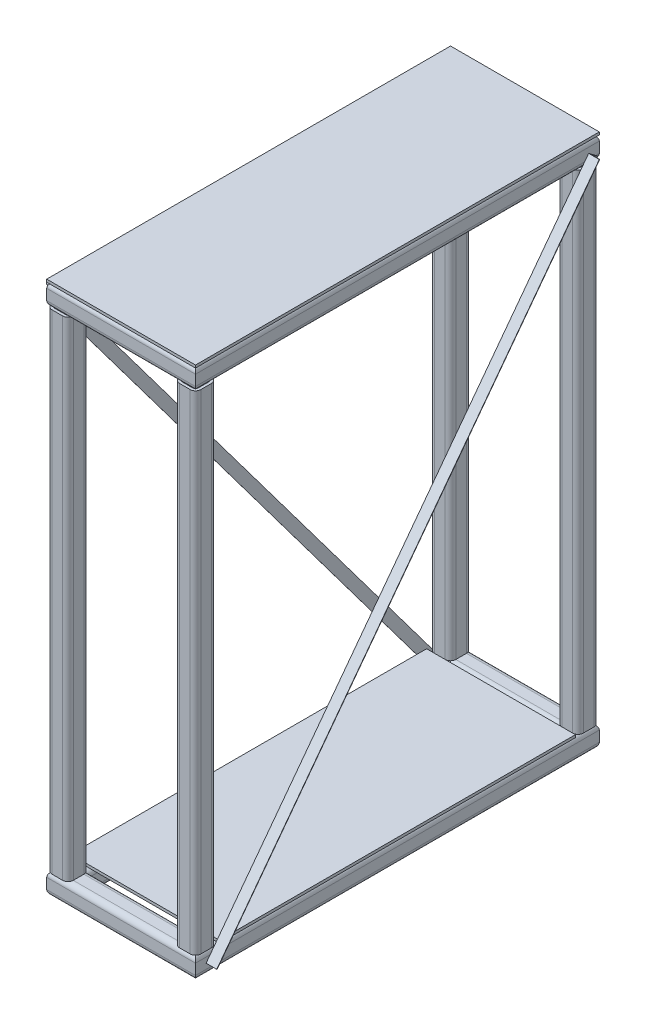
SolidWorks part; units mm, degrees
other "DetailItem37" parameters "D1"=109.4792, "D2"=100.0708
other "DetailItem38"
other "DetailItem39"
other "DetailItem40"
other "DetailItem41"
other "Grid System1" parameters "D1"=1219.2, "D2"=1219.2, "D3"=0, "D4"=0
sketch "Sketch1" plane through (0, 0, 0) normal (0, 1, 0) x (1, 0, 0)
  line L0 (-152.4, 0) -> (152.4, 0)
  line L1 (-152.4, 457.2) -> (152.4, 457.2)
  line L2 (-152.4, 457.2) -> (-152.4, -457.2)
  line L3 (-152.4, -457.2) -> (152.4, -457.2)
  line L4 (152.4, 457.2) -> (152.4, -457.2)
  line L5 (-152.4, 457.2) -> (152.4, -457.2) construction
  line L6 (-152.4, -457.2) -> (152.4, 457.2) construction
  point P8 (-152.4, 0)
  point P9 (152.4, 0)
  point P10 (-152.4, 457.2)
  point P11 (152.4, 457.2)
  point P12 (-152.4, -457.2)
  point P13 (152.4, -457.2)
ref_plane "Level1" through (0, 1219.2, 0) normal (0, 1, 0) x (1, 0, 0)
sketch "Sketch2" plane through (0, 1219.2, 0) normal (0, 1, 0) x (1, 0, 0)
  line L0 (-152.4, 0) -> (152.4, 0)
  line L1 (-152.4, 457.2) -> (152.4, 457.2)
  line L2 (-152.4, 457.2) -> (-152.4, -457.2)
  line L3 (-152.4, -457.2) -> (152.4, -457.2)
  line L4 (152.4, 457.2) -> (152.4, -457.2)
  line L5 (-152.4, 457.2) -> (152.4, -457.2) construction
  line L6 (-152.4, -457.2) -> (152.4, 457.2) construction
  point P8 (-152.4, 0)
  point P9 (152.4, 0)
  point P10 (-152.4, 457.2)
  point P11 (152.4, 457.2)
  point P12 (-152.4, -457.2)
  point P13 (152.4, -457.2)
sketch3d "3DSketch1"
  line L0 (-152.4, 0, 0) -> (-152.4, 1219.2, 0)
  line L1 (152.4, 0, 0) -> (152.4, 1219.2, 0)
  line L2 (-152.4, 0, -457.2) -> (-152.4, 1219.2, -457.2)
  line L3 (152.4, 0, -457.2) -> (152.4, 1219.2, -457.2)
  line L4 (-152.4, 0, 457.2) -> (-152.4, 1219.2, 457.2)
  line L5 (152.4, 0, 457.2) -> (152.4, 1219.2, 457.2)
surface "Surface-Extrude1" sketch "Sketch1"
ref_plane "Front Plane" through (0, 0, 0) normal (0, 0, 1) x (1, 0, 0)
ref_plane "Top Plane" through (0, 0, 0) normal (0, 1, 0) x (1, 0, 0)
ref_plane "Right Plane" through (0, 0, 0) normal (1, 0, 0) x (0, 0, -1)
other "Structural Member1"
ref_plane "Plane2" through (152.4, 0, -457.2) normal (0, 0, 1) x (1, 0, 0)
sketch "Sketch11" plane through (152.4, 0, -457.2) normal (0, 0, 1) x (1, 0, 0)
  line L0 (-12.7, -19.05) -> (12.7, -19.05)
  line L1 (-19.05, -12.7) -> (-19.05, 12.7)
  line L2 (12.7, 19.05) -> (-12.7, 19.05)
  line L3 (19.05, 12.7) -> (19.05, -12.7)
  line L4 (-12.7, -25.4) -> (12.7, -25.4)
  line L5 (-25.4, -12.7) -> (-25.4, 12.7)
  line L6 (12.7, 25.4) -> (-12.7, 25.4)
  line L7 (25.4, 12.7) -> (25.4, -12.7)
  line L8 (0, 0) -> (19.05, 0) construction
  line L9 (0, 0) -> (0, 19.05) construction
  arc A0 (25.4, 12.7) -> (12.7, 25.4) centre (12.7, 12.7) ccw
  arc A1 (12.7, -25.4) -> (25.4, -12.7) centre (12.7, -12.7) ccw
  arc A2 (-25.4, -12.7) -> (-12.7, -25.4) centre (-12.7, -12.7) ccw
  arc A3 (-12.7, 25.4) -> (-25.4, 12.7) centre (-12.7, 12.7) ccw
  arc A4 (-12.7, 19.05) -> (-19.05, 12.7) centre (-12.7, 12.7) ccw
  arc A5 (19.05, 12.7) -> (12.7, 19.05) centre (12.7, 12.7) ccw
  arc A6 (12.7, -19.05) -> (19.05, -12.7) centre (12.7, -12.7) ccw
  arc A7 (-19.05, -12.7) -> (-12.7, -19.05) centre (-12.7, -12.7) ccw
  point P3 (0, 25.4)
  point P4 (25.4, 0)
  point P5 (0, -25.4)
  point P6 (-25.4, 0)
  point P7 (-25.4, 25.4)
  point P8 (-25.4, -25.4)
  point P33 (0, 0)
  point P35 (25.4, -25.4)
  point P36 (25.4, 25.4)
  point P37 (0, 0)
  dimension "D1" = 12.7
  dimension "Thickness" = 6.35
  dimension "V_leg" = 50.8
other "Structural Member2"
ref_plane "Plane3" through (-152.4, 1219.2, 457.2) normal (1, 0, 0) x (0, 0, -1)
sketch "Sketch12" plane through (-152.4, 1219.2, 457.2) normal (1, 0, 0) x (0, 0, -1)
  line L0 (-12.7, -19.05) -> (12.7, -19.05)
  line L1 (-19.05, -12.7) -> (-19.05, 12.7)
  line L2 (12.7, 19.05) -> (-12.7, 19.05)
  line L3 (19.05, 12.7) -> (19.05, -12.7)
  line L4 (-12.7, -25.4) -> (12.7, -25.4)
  line L5 (-25.4, -12.7) -> (-25.4, 12.7)
  line L6 (12.7, 25.4) -> (-12.7, 25.4)
  line L7 (25.4, 12.7) -> (25.4, -12.7)
  line L8 (0, 0) -> (19.05, 0) construction
  line L9 (0, 0) -> (0, 19.05) construction
  arc A0 (25.4, 12.7) -> (12.7, 25.4) centre (12.7, 12.7) ccw
  arc A1 (12.7, -25.4) -> (25.4, -12.7) centre (12.7, -12.7) ccw
  arc A2 (-25.4, -12.7) -> (-12.7, -25.4) centre (-12.7, -12.7) ccw
  arc A3 (-12.7, 25.4) -> (-25.4, 12.7) centre (-12.7, 12.7) ccw
  arc A4 (-12.7, 19.05) -> (-19.05, 12.7) centre (-12.7, 12.7) ccw
  arc A5 (19.05, 12.7) -> (12.7, 19.05) centre (12.7, 12.7) ccw
  arc A6 (12.7, -19.05) -> (19.05, -12.7) centre (12.7, -12.7) ccw
  arc A7 (-19.05, -12.7) -> (-12.7, -19.05) centre (-12.7, -12.7) ccw
  point P3 (0, 25.4)
  point P4 (25.4, 0)
  point P5 (0, -25.4)
  point P6 (-25.4, 0)
  point P7 (-25.4, 25.4)
  point P8 (-25.4, -25.4)
  point P33 (0, 0)
  point P35 (25.4, -25.4)
  point P36 (25.4, 25.4)
  point P37 (0, 0)
  dimension "D1" = 12.7
  dimension "Thickness" = 6.35
  dimension "V_leg" = 50.8
other "Structural Member3"
ref_plane "Plane4" through (152.4, 0, 457.2) normal (0, 1, 0) x (1, 0, 0)
sketch "Sketch13" plane through (152.4, 0, 457.2) normal (0, 1, 0) x (1, 0, 0)
  line L0 (-12.7, -19.05) -> (12.7, -19.05)
  line L1 (-19.05, -12.7) -> (-19.05, 12.7)
  line L2 (12.7, 19.05) -> (-12.7, 19.05)
  line L3 (19.05, 12.7) -> (19.05, -12.7)
  line L4 (-12.7, -25.4) -> (12.7, -25.4)
  line L5 (-25.4, -12.7) -> (-25.4, 12.7)
  line L6 (12.7, 25.4) -> (-12.7, 25.4)
  line L7 (25.4, 12.7) -> (25.4, -12.7)
  line L8 (0, 0) -> (19.05, 0) construction
  line L9 (0, 0) -> (0, 19.05) construction
  arc A0 (25.4, 12.7) -> (12.7, 25.4) centre (12.7, 12.7) ccw
  arc A1 (12.7, -25.4) -> (25.4, -12.7) centre (12.7, -12.7) ccw
  arc A2 (-25.4, -12.7) -> (-12.7, -25.4) centre (-12.7, -12.7) ccw
  arc A3 (-12.7, 25.4) -> (-25.4, 12.7) centre (-12.7, 12.7) ccw
  arc A4 (-12.7, 19.05) -> (-19.05, 12.7) centre (-12.7, 12.7) ccw
  arc A5 (19.05, 12.7) -> (12.7, 19.05) centre (12.7, 12.7) ccw
  arc A6 (12.7, -19.05) -> (19.05, -12.7) centre (12.7, -12.7) ccw
  arc A7 (-19.05, -12.7) -> (-12.7, -19.05) centre (-12.7, -12.7) ccw
  point P3 (0, 25.4)
  point P4 (25.4, 0)
  point P5 (0, -25.4)
  point P6 (-25.4, 0)
  point P7 (-25.4, 25.4)
  point P8 (-25.4, -25.4)
  point P33 (0, 0)
  point P35 (25.4, -25.4)
  point P36 (25.4, 25.4)
  point P37 (0, 0)
  dimension "D1" = 12.7
  dimension "Thickness" = 6.35
  dimension "V_leg" = 50.8
other "Trim/Extend1"
sketch "Sketch17" plane through (177.8, 0, 0) normal (1, 0, 0) x (0, 0, -1)
  line L0 (457.2, 1219.2) -> (-457.2, 0)
other "Structural Member4"
ref_plane "Plane5" through (177.8, 1219.2, -457.2) normal (0, -0.8, 0.6) x (0, -0.6, -0.8)
sketch "Sketch19" plane through (177.8, 1219.2, -457.2) normal (0, -0.8, 0.6) x (0, -0.6, -0.8)
  line L0 (0, 0) -> (0, 25.4)
  line L1 (0, 25.4) -> (0.0051, 25.4)
  line L2 (3.175, 22.2301) -> (3.175, 7.9375)
  line L3 (7.9375, 3.175) -> (22.2301, 3.175)
  line L4 (25.4, 0.0051) -> (25.4, 0)
  line L5 (25.4, 0) -> (0, 0)
  arc A0 (25.4, 0.0051) -> (22.2301, 3.175) centre (22.2301, 0.0051) ccw
  arc A1 (0.0051, 25.4) -> (3.175, 22.2301) centre (0.0051, 22.2301) cw
  arc A2 (7.9375, 3.175) -> (3.175, 7.9375) centre (7.9375, 7.9375) cw
  point P10 (12.7, 0)
  point P14 (0, 12.7)
  point P15 (3.175, 12.7)
  point P16 (12.7, 3.175)
  point P17 (3.175, 25.4)
  point P18 (25.4, 3.175)
  point P19 (0, 0)
  dimension "D2" = 0.0051
  dimension "Radius_1" = 4.7625
  dimension "D1" = 3.175
  dimension "H_leg" = 25.4
sketch "Sketch20" plane through (-177.8, 0, 0) normal (-1, 0, 0) x (0, 0, 1)
  line L1 (-457.2, 0) -> (457.2, 1219.2)
other "Structural Member5"
ref_plane "Plane6"
sketch "Sketch110" plane through (-177.8, 0, -457.2) normal (0, -0.8, -0.6) x (0, -0.6, 0.8)
  line L0 (0, 0) -> (0, 25.4)
  line L1 (0, 25.4) -> (0.0051, 25.4)
  line L2 (3.175, 22.2301) -> (3.175, 7.9375)
  line L3 (7.9375, 3.175) -> (22.2301, 3.175)
  line L4 (25.4, 0.0051) -> (25.4, 0)
  line L5 (25.4, 0) -> (0, 0)
  arc A0 (25.4, 0.0051) -> (22.2301, 3.175) centre (22.2301, 0.0051) ccw
  arc A1 (0.0051, 25.4) -> (3.175, 22.2301) centre (0.0051, 22.2301) cw
  arc A2 (7.9375, 3.175) -> (3.175, 7.9375) centre (7.9375, 7.9375) cw
  point P10 (12.7, 0)
  point P14 (0, 12.7)
  point P15 (3.175, 12.7)
  point P16 (12.7, 3.175)
  point P17 (3.175, 25.4)
  point P18 (25.4, 3.175)
  point P19 (0, 0)
  dimension "D2" = 0.0051
  dimension "Radius_1" = 4.7625
  dimension "D1" = 3.175
  dimension "H_leg" = 25.4
sketch "Sketch14" plane through (0, 25.4, 0) normal (0, 1, 0) x (1, 0, 0)
  line L0 (177.8, 482.6) -> (177.8, -482.6) construction
  line L1 (-177.8, -425.45) -> (177.8, -425.45)
  line L2 (-177.8, -425.45) -> (-177.8, 425.45)
  line L3 (-177.8, 425.45) -> (177.8, 425.45)
  line L4 (177.8, -425.45) -> (177.8, 425.45)
  line L5 (-177.8, -482.6) -> (-177.8, 482.6) construction
  line L6 (-139.7, 431.8) -> (-165.1, 431.8) construction
  line L7 (-165.1, -431.8) -> (-139.7, -431.8) construction
  dimension "D1" = 6.35
  dimension "D2" = 6.35
extrude "Boss-Extrude1" add sketch "Sketch14" along normal blind 6.35 separate body
sketch "Sketch15" plane through (0, 1244.6, 0) normal (0, 1, 0) x (1, 0, 0)
  line L1 (-177.8, -482.6) -> (177.8, -482.6)
  line L2 (-177.8, -482.6) -> (-177.8, 482.6)
  line L3 (-177.8, 482.6) -> (177.8, 482.6)
  line L4 (177.8, -482.6) -> (177.8, 482.6)
extrude "Boss-Extrude2" add sketch "Sketch15" along normal blind 6.35 separate body
